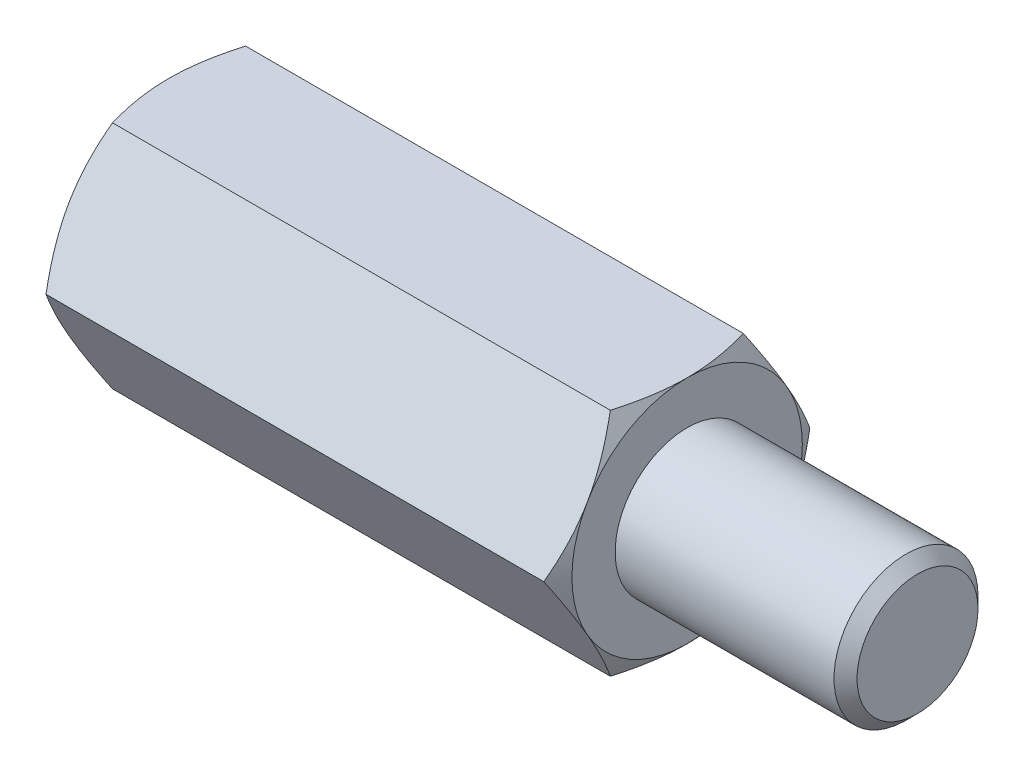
SolidWorks part; units mm, degrees
ref_plane "Front Plane" through (0, 0, 0) normal (0, 0, 1) x (1, 0, 0)
ref_plane "Top Plane" through (0, 0, 0) normal (0, 1, 0) x (1, 0, 0)
ref_plane "Right Plane" through (0, 0, 0) normal (1, 0, 0) x (0, 0, -1)
sketch "Sketch1" plane through (0, 0, 0) normal (1, 0, 0) x (0, 0, -1)
  line L1 (2.3094, 4) -> (-2.3094, 4)
  line L2 (-2.3094, 4) -> (-4.6188, 0)
  line L3 (-4.6188, 0) -> (-2.3094, -4)
  line L4 (-2.3094, -4) -> (2.3094, -4)
  line L5 (2.3094, -4) -> (4.6188, 0)
  line L6 (4.6188, 0) -> (2.3094, 4)
  circle A0 centre (0, 0) radius 4 construction
  dimension "D1" = 8
extrude "Extrude2" add sketch "Sketch1" along normal mid plane 18
sketch "Sketch2" plane through (0, 0, 0) normal (0, 0, 1) x (1, 0, 0)
  line L0 (-9, 4) -> (-7.5, 6.5981)
  line L1 (-9, 7) -> (-9, 4)
  line L3 (0, 0) -> (50000, 0) construction
  arc A0 (-7.5, 6.5981) -> (-9, 7) centre (-8.1962, 7) ccw
  dimension "D1" = 30
  dimension "D2" = 3
revolve "Cut-Revolve1" cut sketch "Sketch2" angle 360 about L3
mirror "Mirror1" about plane through (0, 0, 0) normal (1, 0, 0) of "Cut-Revolve1"
sketch "Sketch3" plane through (-9, 0, 0) normal (-1, 0, 0) x (0, 0, 1)
  circle A0 centre (0, 0) radius 2.1
  dimension "D1" = 4.2
extrude "Extrude3" cut sketch "Sketch3" against normal blind 8
sketch "Sketch4" plane through (0, 0, 0) normal (0, 0, 1) x (1, 0, 0)
  line L0 (-1, 0) -> (-1, 2.1)
  line L1 (8.6427, 0) -> (-8.6427, 0) construction
  line L2 (-1, 2.1) -> (0.2124, 0)
  line L3 (0.2124, 0) -> (-1, 0)
  line L4 (-9, 2) -> (-9, -2) construction
  point P4 (-9, 0)
  dimension "D1" = 30
  dimension "D2" = 2.1
  dimension "D3" = 8
revolve "Cut-Revolve2" cut sketch "Sketch4" angle 360 about L3
sketch "Sketch5" plane through (9, 0, 0) normal (1, 0, 0) x (0, 0, -1)
  circle A0 centre (0, 0) radius 2.5
  dimension "D1" = 5
extrude "Extrude4" add sketch "Sketch5" along normal blind 8
chamfer "Chamfer1" distance 0.4 angle 45 1 edges at (17, 0, -2.5)
equation "\"D2@Sketch4\" = \"D1@Sketch3\"/2"
